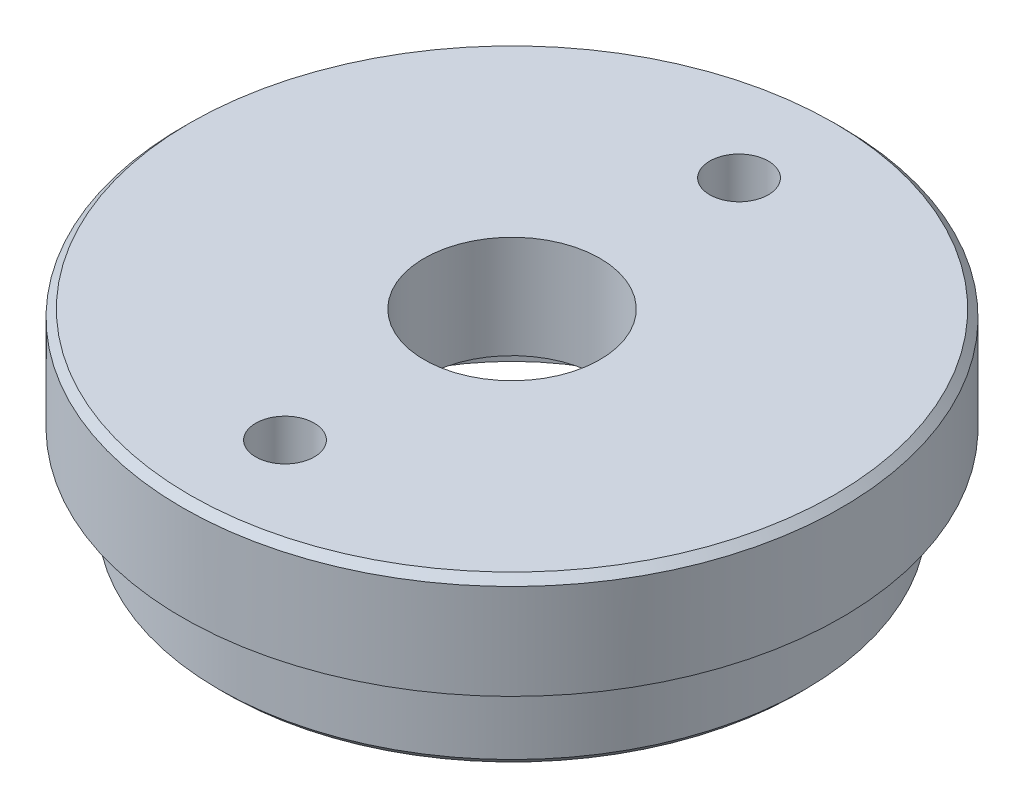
SolidWorks part; units mm, degrees
ref_plane "Face" through (0, 0, 0) normal (0, 0, 1) x (1, 0, 0)
ref_plane "Gauche" through (0, 0, 0) normal (0, 1, 0) x (1, 0, 0)
ref_plane "Dessus" through (0, 0, 0) normal (1, 0, 0) x (0, 0, -1)
sketch "Esquisse1" plane through (0, 0, 0) normal (0, 0, 1) x (1, 0, 0)
  line L0 (0, -39) -> (0, 49) construction
  line L1 (6, 7) -> (22.5, 7)
  line L2 (22.5, 7) -> (22.5, 0)
  line L3 (22.5, 0) -> (20, 0)
  line L4 (20, 0) -> (20, -6)
  line L5 (20, -6) -> (14, -6)
  line L6 (14, -6) -> (14, 0)
  line L7 (14, 0) -> (6, 0)
  line L8 (6, 0) -> (6, 7)
  dimension "D1" = 6
  dimension "D2" = 22.5
  dimension "D3" = 14
  dimension "D4" = 20
  dimension "D5" = 7
  dimension "D6" = 13
  dimension "D8" = 6
revolve "Base-Révolution" add sketch "Esquisse1"
chamfer "Chanfrein1" distance 0.5 angle 45
hole_wizard "Perçage1" positions "Esquisse3" profile "Esquisse2" hole size "M1" standard "ISO"
sketch "Esquisse3" plane through (0, 7, 0) normal (0, 1, 0) x (-1, 0, 0)
  point P0 (0, 15.5)
  dimension "D1" = 15.5
sketch "Esquisse2" plane through (0, 7, 15.5) normal (1, 0, 0) x (0, 0, 1)
  line L0 (0, 0) -> (0, 5.2017)
  line L1 (0, 5.2017) -> (2, 4)
  line L2 (2, 4) -> (2, 0)
  line L5 (2, 0) -> (0, 0)
  line L10 (0, 5.2017) -> (-2, 4) construction
  line L11 (0, -6.35) -> (0, 107.95) construction
  dimension "Diamètre du perçage" = 4
  dimension "Profondeur du perçage" = 4
  dimension "Angle de pointe" = 118
mirror "Symétrie1" about plane through (0, 0, 0) normal (0, 0, 1)
